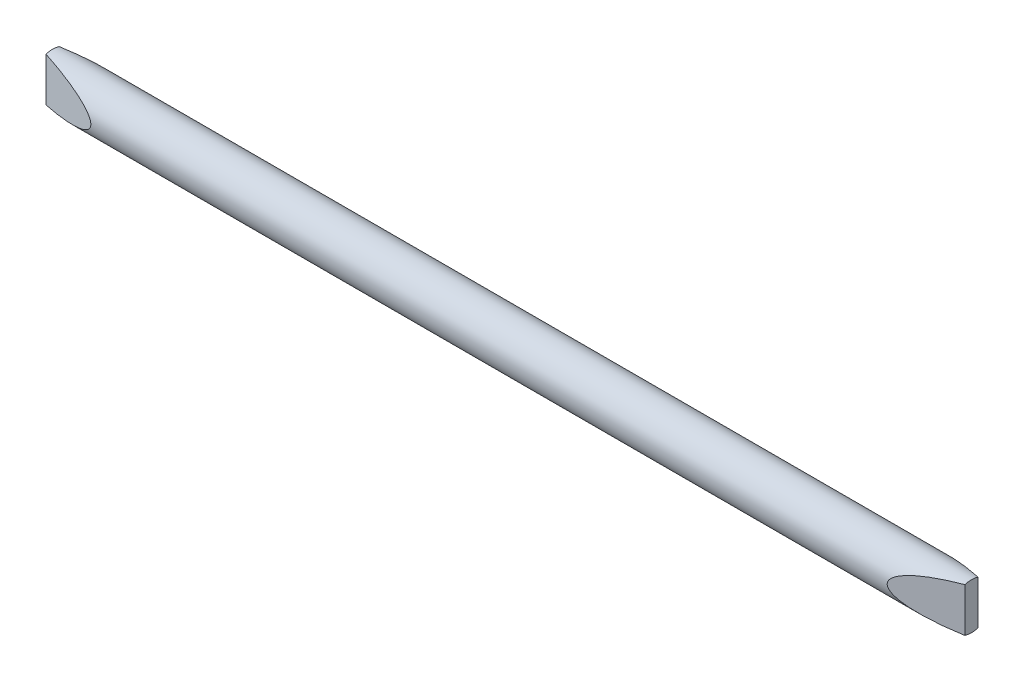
SolidWorks part; units mm, degrees
ref_plane "Front Plane" through (0, 0, 0) normal (0, 0, 1) x (1, 0, 0)
ref_plane "Top Plane" through (0, 0, 0) normal (0, 1, 0) x (1, 0, 0)
ref_plane "Right Plane" through (0, 0, 0) normal (1, 0, 0) x (0, 0, -1)
sketch "Sketch1" plane through (0, 0, 0) normal (0, 0, 1) x (1, 0, 0)
  line L0 (0, 0) -> (120, 0)
  line L1 (120, 0) -> (120, 3)
  line L2 (120, 3) -> (0, 3)
  line L3 (0, 3) -> (0, 0)
  dimension "D1" = 3
  dimension "D2" = 120
revolve "Revolve1" add sketch "Sketch1" angle 360 about L0
sketch "Sketch3" plane through (0, 0, 0) normal (0, 1, 0) x (1, 0, 0)
  line L0 (120, 0.8564) -> (112, 3)
  line L1 (120, -3) -> (120, 3) construction
  line L2 (120, 3) -> (0, 3) construction
  line L3 (112, 3) -> (120, 3)
  line L4 (120, 3) -> (120, 0.8564)
  line L5 (120, 0) -> (131.2374, 0) construction
  line L6 (-3.3, 0) -> (3.3, 0) construction
  line L7 (120, -3) -> (120, -0.8564)
  line L8 (112, -3) -> (120, -3)
  line L9 (120, -0.8564) -> (112, -3)
  line L10 (60, 3) -> (60, 24.2452) construction
  line L11 (0, 0) -> (-11.2374, 0) construction
  line L12 (0, -0.8564) -> (8, -3)
  line L13 (8, -3) -> (0, -3)
  line L14 (0, -3) -> (0, -0.8564)
  line L15 (0, 3) -> (0, 0.8564)
  line L16 (8, 3) -> (0, 3)
  line L17 (0, 0.8564) -> (8, 3)
  dimension "D1" = 15
  dimension "D2" = 8
extrude "Cut-Extrude1" cut sketch "Sketch3" against normal mid plane 30
